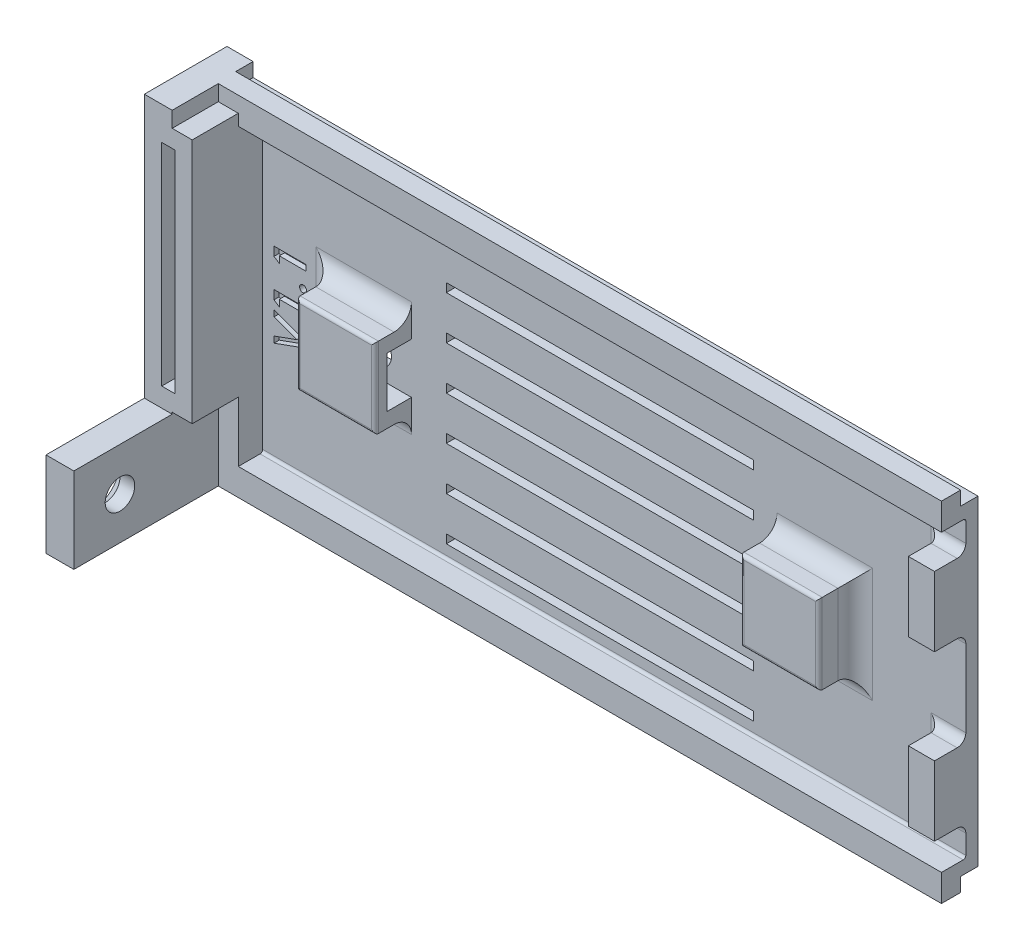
SolidWorks part; units mm, degrees
ref_plane "Front Plane" through (0, 0, 0) normal (0, 0, 1) x (1, 0, 0)
ref_plane "Top Plane" through (0, 0, 0) normal (0, 1, 0) x (1, 0, 0)
ref_plane "Right Plane" through (0, 0, 0) normal (1, 0, 0) x (0, 0, -1)
sketch "Sketch1" plane through (0, 0, 0) normal (0, 0, 1) x (1, 0, 0)
  line L1 (-15.75, 6.925) -> (68.35, 6.925)
  line L2 (-15.75, 6.925) -> (-15.75, -33.125)
  line L3 (-15.75, -33.125) -> (68.35, -33.125)
  line L4 (68.35, 6.925) -> (68.35, -33.125)
  dimension "D1" = 40.05
  dimension "D2" = 84.1
extrude "Boss-Extrude1" add sketch "Sketch1" along normal blind 1.4
ref_plane "Plane1" through (0, 0, 1.4) normal (0, 0, 1) x (1, 0, 0)
sketch "Sketch5" plane through (0, 0, 0) normal (0, 0, 1) x (1, 0, 0)
  line L0 (-15.75, 6.925) -> (-15.75, -33.125) construction
  line L1 (-15.75, 6.925) -> (-17.95, 6.925)
  line L2 (-15.75, 6.925) -> (-15.75, -33.125)
  line L3 (-15.75, -33.125) -> (-17.95, -33.125)
  line L4 (-17.95, 6.925) -> (-17.95, -33.125)
  dimension "D1" = 2.2
extrude "Boss-Extrude3" add sketch "Sketch5" along normal blind 9.5
ref_plane "Plane2" through (0, 0, 9.5) normal (0, 0, 1) x (1, 0, 0)
sketch "Sketch7" plane through (0, 0, 0) normal (0, 0, 1) x (1, 0, 0)
  line L0 (68.35, 6.925) -> (-17.95, 6.925) construction
  line L1 (8.65, -2.575) -> (43.95, -2.575)
  line L2 (43.95, 2.425) -> (8.65, 2.425)
  line L3 (43.95, 2.425) -> (43.95, 1.425)
  line L4 (43.95, 1.425) -> (8.65, 1.425)
  line L5 (8.65, 2.425) -> (8.65, 1.425)
  line L6 (8.65, -2.575) -> (8.65, -3.575)
  line L7 (8.65, -3.575) -> (43.95, -3.575)
  line L8 (43.95, -2.575) -> (43.95, -3.575)
  line L9 (8.65, -17.575) -> (43.95, -17.575)
  line L10 (8.65, -17.575) -> (8.65, -18.575)
  line L11 (8.65, -18.575) -> (43.95, -18.575)
  line L12 (43.95, -17.575) -> (43.95, -18.575)
  line L14 (68.35, -33.125) -> (68.35, 6.925) construction
  line L15 (8.65, -7.575) -> (43.95, -7.575)
  line L16 (8.65, -7.575) -> (8.65, -8.575)
  line L17 (8.65, -8.575) -> (43.95, -8.575)
  line L18 (43.95, -7.575) -> (43.95, -8.575)
  line L19 (8.65, -12.575) -> (43.95, -12.575)
  line L20 (8.65, -12.575) -> (8.65, -13.575)
  line L21 (8.65, -13.575) -> (43.95, -13.575)
  line L22 (43.95, -12.575) -> (43.95, -13.575)
  line L23 (43.95, -27.575) -> (8.65, -27.575)
  line L24 (43.95, -27.575) -> (43.95, -28.575)
  line L25 (43.95, -22.575) -> (8.65, -22.575)
  line L26 (43.95, -22.575) -> (43.95, -23.575)
  line L27 (43.95, -23.575) -> (8.65, -23.575)
  line L28 (8.65, -22.575) -> (8.65, -23.575)
  line L29 (-17.95, 6.925) -> (-17.95, -33.125) construction
  line L30 (43.95, -28.575) -> (8.65, -28.575)
  line L31 (8.65, -27.575) -> (8.65, -28.575)
  dimension "D1" = 4.5
  dimension "D2" = 1
  dimension "D3" = 1
  dimension "D4" = 1
  dimension "D5" = 4
  dimension "D6" = 4
  dimension "D7" = 1
  dimension "D8" = 4
  dimension "D9" = 1
  dimension "D10" = 4
  dimension "D11" = 24.4
  dimension "D12" = 26.6
  dimension "D13" = 1
  dimension "D14" = 4
  dimension "D15" = 1
  dimension "D16" = 4
extrude "Cut-Extrude1" cut sketch "Sketch7" along normal blind 2
ref_plane "Plane3" through (-17.95, 0, 0) normal (-1, 0, 0) x (0, 0, 1)
sketch "Sketch11" plane through (0, 0, 1.4) normal (0, 0, 1) x (1, 0, 0)
  line L0 (68.35, -33.125) -> (68.35, 6.925) construction
  line L1 (-17.95, -33.125) -> (68.35, -33.125)
  line L2 (-17.95, -33.125) -> (-17.95, -30.025)
  line L3 (-17.95, -30.025) -> (68.35, -30.025)
  line L4 (68.35, -33.125) -> (68.35, -30.025)
  line L5 (-15.75, -33.125) -> (68.35, -33.125) construction
  line L6 (-17.95, 6.925) -> (68.35, 6.925)
  line L7 (-17.95, 6.925) -> (-17.95, 3.825)
  line L8 (-17.95, 3.825) -> (68.35, 3.825)
  line L9 (68.35, 6.925) -> (68.35, 3.825)
  dimension "D1" = 3.1
  dimension "D2" = 3.1
extrude "Boss-Extrude4" add sketch "Sketch11" along normal blind 2.8
sketch "Sketch9" plane through (0, 0, 0) normal (0, 0, 1) x (1, 0, 0)
  line L0 (68.35, -33.125) -> (68.35, 6.925) construction
  line L1 (-17.95, -33.125) -> (68.35, -33.125)
  line L2 (-17.95, -33.125) -> (-17.95, -31.525)
  line L3 (-17.95, -31.525) -> (68.35, -31.525)
  line L4 (68.35, -33.125) -> (68.35, -31.525)
  line L5 (-17.95, 6.925) -> (-17.95, -33.125) construction
  line L6 (68.35, 6.925) -> (-17.95, 6.925)
  line L7 (68.35, 6.925) -> (68.35, 5.325)
  line L8 (68.35, 5.325) -> (-17.95, 5.325)
  line L9 (-17.95, 6.925) -> (-17.95, 5.325)
  dimension "D1" = 1.6
  dimension "D2" = 1.6
extrude "Cut-Extrude4" cut sketch "Sketch9" along normal blind 2
sketch "Sketch18" plane through (0, 0, 1.4) normal (0, 0, 1) x (1, 0, 0)
  line L0 (68.35, 6.925) -> (-15.75, 6.925) construction
  line L1 (-15.95, -33.125) -> (-12.45, -33.125)
  line L2 (-15.95, -33.125) -> (-15.95, 6.925)
  line L3 (-15.95, 6.925) -> (-12.45, 6.925)
  line L4 (-12.45, -33.125) -> (-12.45, 6.925)
  line L5 (-17.95, 6.925) -> (-17.95, -33.125) construction
  line L6 (-15.75, -33.125) -> (68.35, -33.125) construction
  dimension "D1" = 3.5
  dimension "D2" = 2
extrude "Boss-Extrude7" add sketch "Sketch18" along normal up to surface (8.1 mm away)
sketch "Sketch20" plane through (0, 0, 0) normal (0, 0, 1) x (1, 0, 0)
  line L1 (8.65, -17.575) -> (5.65, -17.575)
  line L2 (8.65, -17.575) -> (8.65, -8.575)
  line L3 (8.65, -8.575) -> (5.65, -8.575)
  line L4 (5.65, -17.575) -> (5.65, -8.575)
  dimension "D1" = 3
ref_plane "Plane4" through (68.35, 0, 0) normal (1, 0, 0) x (0, 0, -1)
fillet "Fillet2" radius 0.3 2 edges at (27.95, 3.825, 1.4) (27.95, -30.025, 1.4)
ref_plane "Plane5" through (0, 0, 9.5) normal (0, 0, 1) x (1, 0, 0)
sketch "Sketch23" plane through (0, 0, 9.5) normal (0, 0, 1) x (1, 0, 0)
  line L0 (-12.45, -33.125) -> (-12.45, 6.925) construction
  line L1 (-12.45, 5.125) -> (-14.75, 5.125)
  line L2 (-12.45, 5.125) -> (-12.45, 6.925)
  line L3 (-12.45, 6.925) -> (-14.75, 6.925)
  line L4 (-14.75, 5.125) -> (-14.75, 6.925)
  line L5 (-12.45, 6.925) -> (-17.95, 6.925) construction
  line L6 (-17.95, 6.925) -> (-17.95, -33.125) construction
  line L7 (-17.95, 6.925) -> (-17.95, -33.125) construction
  line L8 (-12.45, -33.125) -> (-17.95, -33.125) construction
  line L9 (-12.45, -33.125) -> (-14.75, -33.125)
  line L10 (-12.45, -33.125) -> (-12.45, -23.125)
  line L11 (-12.45, -23.125) -> (-14.75, -23.125)
  line L13 (-14.75, -33.125) -> (-14.75, -23.125)
  dimension "D1" = 3.2
  dimension "D2" = 1.8
  dimension "D3" = 10
  dimension "D4" = 3.2
extrude "Cut-Extrude11" cut sketch "Sketch23" against normal up to surface (5.3 mm away)
sketch "Sketch26" plane through (0, 0, 1.4) normal (0, 0, 1) x (1, 0, 0)
  line L1 (-12.45, 6.925) -> (-15.95, 6.925)
  line L2 (-12.45, 6.925) -> (-12.45, 5.325)
  line L3 (-12.45, 5.325) -> (-15.95, 5.325)
  line L4 (-15.95, 6.925) -> (-15.95, 5.325)
  line L5 (-12.45, -33.125) -> (-15.95, -33.125)
  line L6 (-12.45, -33.125) -> (-12.45, -31.525)
  line L7 (-12.45, -31.525) -> (-15.95, -31.525)
  line L8 (-15.95, -33.125) -> (-15.95, -31.525)
extrude "Cut-Extrude12" cut sketch "Sketch26" along normal up to surface (0.6 mm away)
sketch "Sketch29" plane through (68.35, 0, 0) normal (1, 0, 0) x (0, 0, -1)
  line L1 (-4.2, -33.125) -> (-3.2, -33.125)
  line L2 (-4.2, -33.125) -> (-4.2, 6.925)
  line L3 (-4.2, 6.925) -> (-3.2, 6.925)
  line L4 (-3.2, -33.125) -> (-3.2, 6.925)
  dimension "D1" = 1
sketch "Sketch30" plane through (0, 0, 9.5) normal (0, 0, 1) x (1, 0, 0)
  line L0 (-17.95, 6.925) -> (-17.95, -33.125) construction
  line L1 (-15.95, 3.125) -> (-14.45, 3.125)
  line L2 (-15.95, 3.125) -> (-15.95, -21.125)
  line L3 (-15.95, -21.125) -> (-14.45, -21.125)
  line L4 (-14.45, 3.125) -> (-14.45, -21.125)
  line L5 (-14.75, 5.125) -> (-12.45, 5.125) construction
  line L6 (-12.45, 5.125) -> (-12.45, -23.125) construction
  line L7 (-14.75, -23.125) -> (-12.45, -23.125) construction
  dimension "D1" = 2
  dimension "D2" = 2
  dimension "D3" = 2
  dimension "D4" = 2
extrude "Cut-Extrude16" cut sketch "Sketch30" against normal up to surface (8.1 mm away)
ref_plane "Plane6" through (0, 0, 1) normal (0, 0, -1) x (-1, 0, 0)
sketch "Sketch34" plane through (0, 0, 1.4) normal (0, 0, 1) x (1, 0, 0)
  line L0 (68.35, -29.725) -> (68.35, 3.525) construction
  line L1 (68.35, -26.525) -> (65.35, -26.525)
  line L2 (68.35, -26.525) -> (68.35, -18.525)
  line L3 (68.35, -18.525) -> (65.35, -18.525)
  line L4 (65.35, -26.525) -> (65.35, -18.525)
  line L6 (68.35, -7.675) -> (65.35, -7.675)
  line L7 (68.35, -7.675) -> (68.35, 0.325)
  line L8 (68.35, 0.325) -> (65.35, 0.325)
  line L9 (65.35, -7.675) -> (65.35, 0.325)
  line L11 (-12.45, 3.825) -> (68.35, 3.825) construction
  line L12 (68.35, -30.025) -> (-12.45, -30.025) construction
  point P12 (66.85, 0.325)
  dimension "D1" = 3.5
  dimension "D2" = 8
  dimension "D3" = 3.5
  dimension "D4" = 8
  dimension "D5" = 3
  dimension "D6" = 3
extrude "Boss-Extrude9" add sketch "Sketch34" along normal blind 3.6
fillet "Fillet4" radius 1 6 edges at (66.85, 0.325, 1.4) (66.85, -7.675, 1.4) (65.35, -3.675, 1.4) (66.85, -18.525, 1.4) (65.35, -22.525, 1.4) (66.85, -26.525, 1.4)
ref_plane "Plane7" through (0, 0, 2) normal (0, 0, -1) x (-1, 0, 0)
sketch "Sketch36" plane through (-17.95, 0, 0) normal (-1, 0, 0) x (0, 0, 1)
  line L1 (0, 5.325) -> (2, 5.325)
  line L2 (0, 5.325) -> (0, 6.925)
  line L3 (0, 6.925) -> (2, 6.925)
  line L4 (2, 5.325) -> (2, 6.925)
  line L5 (0, -31.525) -> (2, -31.525)
  line L6 (0, -31.525) -> (0, -33.125)
  line L7 (0, -33.125) -> (2, -33.125)
  line L8 (2, -31.525) -> (2, -33.125)
extrude "Boss-Extrude11" add sketch "Sketch36" against normal blind 3
sketch "Sketch37" plane through (0, 0, 9.5) normal (0, 0, 1) x (1, 0, 0)
  line L0 (-17.95, 6.925) -> (-17.95, -33.125) construction
  line L1 (-14.75, -33.125) -> (-17.95, -33.125)
  line L2 (-14.75, -33.125) -> (-14.75, -23.325)
  line L3 (-14.75, -23.325) -> (-17.95, -23.325)
  line L4 (-17.95, -33.125) -> (-17.95, -23.325)
  dimension "D1" = 9.8
extrude "Boss-Extrude12" add sketch "Sketch37" along normal blind 11.3
sketch "Sketch38" plane through (-17.95, 0, 0) normal (-1, 0, 0) x (0, 0, 1)
  line L0 (20.8, -23.325) -> (20.8, -33.125) construction
  line L1 (20.8, -33.125) -> (0, -33.125) construction
  circle A0 centre (15.5, -28.275) radius 1.7
  dimension "D1" = 3.4
  dimension "D2" = 5.3
  dimension "D3" = 4.85
extrude "Cut-Extrude19" cut sketch "Sketch38" against normal blind 5
hole_wizard "CSK for M3 Flat Head Machine Screw2" positions "Sketch39" profile "Sketch40" countersink size "M3" standard "ANSI Metric"
sketch "Sketch39" plane through (-17.95, 0, 0) normal (-1, 0, 0) x (0, 0, 1)
  point P0 (15.5, -28.275)
sketch "Sketch40" plane through (-17.95, -28.275, 15.5) normal (0, 1, 0) x (0, 0, 1)
  line L0 (0, 0) -> (0, 15.0215)
  line L1 (0, 15.0215) -> (1.7, 14)
  line L2 (1.7, 14) -> (1.7, 1.5)
  line L3 (1.7, 1.5) -> (3.2, 0)
  line L5 (3.2, 0) -> (0, 0)
  line L6 (-1.7, 1.5) -> (-3.2, 0) construction
  line L10 (0, 15.0215) -> (-1.7, 14) construction
  line L11 (0, -6.35) -> (0, 107.95) construction
  dimension "Hole Dia." = 3.4
  dimension "Hole Depth" = 14
  dimension "Near C'Sink Dia." = 6.4
  dimension "Near C'Sink Angle" = 90
  dimension "Drill Angle" = 118
ref_plane "Plane8" through (0, 0, 1.4) normal (0, 0, 1) x (1, 0, 0)
sketch "Sketch31" plane through (0, 0, 0) normal (0, 0, 1) x (1, 0, 0)
  line L0 (-17.95, 6.925) -> (-17.95, -33.125) construction
  circle A0 centre (0.65, -13.1) radius 1.7
  circle A1 centre (50.65, -13.1) radius 1.7
  point P7 (-17.95, -13.1)
  dimension "D1" = 3.4
  dimension "D2" = 3.4
  dimension "D3" = 18.6
  dimension "D4" = 50
sketch "Sketch41" plane through (0, 0, 1.4) normal (0, 0, 1) x (1, 0, 0)
  line L0 (-7.45, -18.625) -> (-7.45, -8.625) construction
  line L1 (-14.75, -33.125) -> (68.35, -33.125) construction
  line L2 (-12.45, 5.125) -> (-12.45, -23.125) construction
  text T0 "V1.1" font "Century Gothic" height in points 14
  dimension "D1" = 10
  dimension "D2" = 14.5
  dimension "D3" = 5
extrude "Cut-Extrude20" cut sketch "Sketch41" against normal blind 0.6
ref_plane "Plane9" through (0, 0, 1.4) normal (0, 0, 1) x (1, 0, 0)
extrude "Cut-Extrude23" cut sketch "Sketch31" along normal blind 2
sketch "Sketch33" plane through (0, 0, 1) normal (0, 0, -1) x (-1, 0, 0)
  line L1 (4.35, -8.5) -> (-4.65, -8.5)
  line L2 (4.35, -8.5) -> (4.35, -17.7)
  line L3 (4.35, -17.7) -> (-4.65, -17.7)
  line L4 (-4.65, -8.5) -> (-4.65, -17.7)
  line L5 (-46.65, -8.5) -> (-55.65, -8.5)
  line L6 (-46.65, -8.5) -> (-46.65, -17.7)
  line L7 (-46.65, -17.7) -> (-55.65, -17.7)
  line L8 (-55.65, -8.5) -> (-55.65, -17.7)
  dimension "D1" = 4.6
  dimension "D2" = 5
  dimension "D3" = 4.6
  dimension "D4" = 4
  dimension "D5" = 5
  dimension "D6" = 4.6
  dimension "D7" = 4
  dimension "D8" = 4.6
extrude "Boss-Extrude15" add sketch "Sketch33" against normal blind 4.6
sketch "Sketch42" plane through (0, 0, 1.4) normal (0, 0, 1) x (1, 0, 0)
  line L1 (-2.75, -16) -> (5.65, -16)
  line L2 (-2.75, -16) -> (-2.75, -10.2)
  line L3 (-2.75, -10.2) -> (5.65, -10.2)
  line L4 (5.65, -16) -> (5.65, -10.2)
  line L7 (45.65, -16) -> (54.05, -16)
  line L8 (45.65, -16) -> (45.65, -10.2)
  line L9 (45.65, -10.2) -> (54.05, -10.2)
  line L10 (54.05, -16) -> (54.05, -10.2)
  dimension "D1" = 2.9
  dimension "D2" = 5
  dimension "D3" = 2.9
  dimension "D4" = 2.9
  dimension "D5" = 3.4
  dimension "D6" = 3.4
  dimension "D7" = 2.9
  dimension "D8" = 5
extrude "Cut-Extrude24" cut sketch "Sketch42" along normal blind 2.8
sketch "Sketch43" plane through (0, 0, 1.4) normal (0, 0, 1) x (1, 0, 0)
  circle A0 centre (50.65, -13.1) radius 1.7
  circle A1 centre (0.65, -13.1) radius 1.7
extrude "Cut-Extrude25" cut sketch "Sketch43" against normal blind 2.8
fillet "Fillet5" radius 2 6 edges at (51.15, -8.5, 1.4) (55.65, -13.1, 1.4) (51.15, -17.7, 1.4) (0.15, -8.5, 1.4) (-4.35, -13.1, 1.4) (0.15, -17.7, 1.4)
fillet "Fillet6" radius 0.4 8 edges at (51.15, -8.5, 5.6) (55.65, -13.1, 5.6) (51.15, -17.7, 5.6) (0.15, -8.5, 5.6) (-4.35, -13.1, 5.6) (0.15, -17.7, 5.6) (46.65, -13.1, 5.6) (4.65, -13.1, 5.6)
